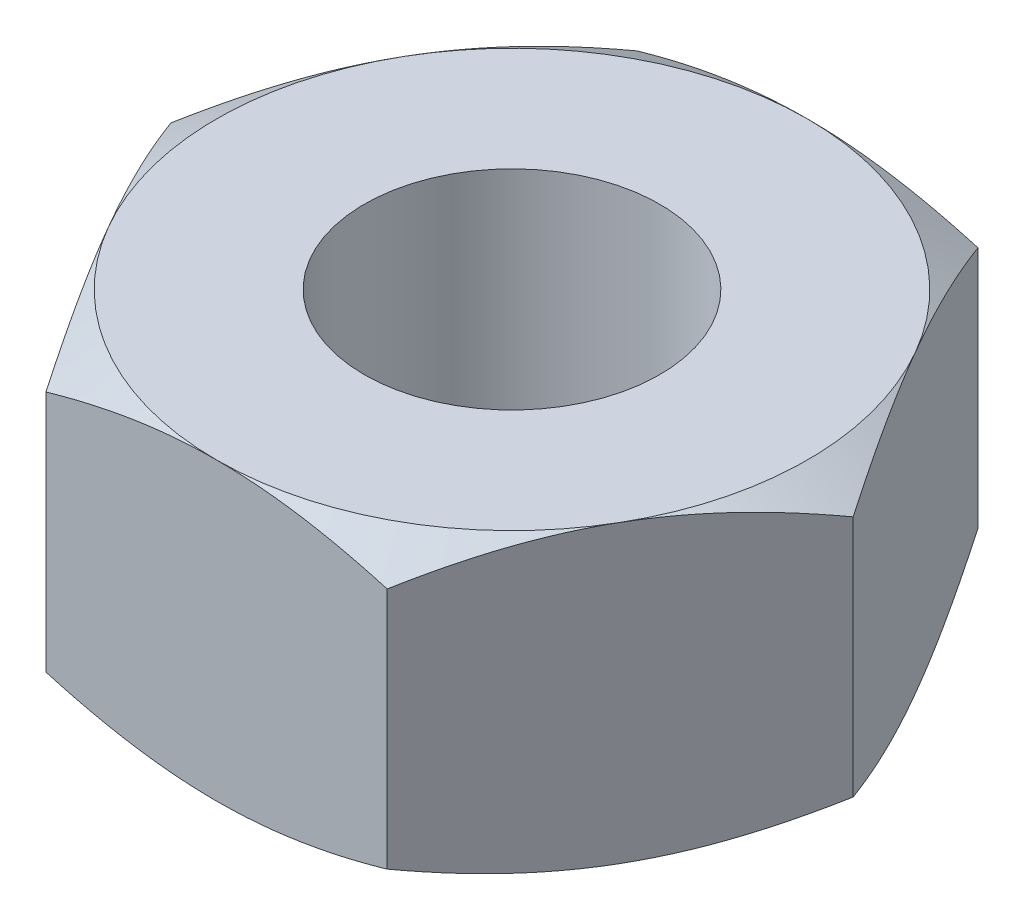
SolidWorks part; units mm, degrees
ref_plane "Plan de face" through (0, 0, 0) normal (0, 0, 1) x (1, 0, 0)
ref_plane "Plan de dessus" through (0, 0, 0) normal (0, 1, 0) x (1, 0, 0)
ref_plane "Plan de droite" through (0, 0, 0) normal (1, 0, 0) x (0, 0, -1)
sketch "Esquisse1" plane through (0, 0, 0) normal (0, 1, 0) x (1, 0, 0)
  line L1 (5.7735, 0) -> (2.8868, 5)
  line L2 (2.8868, 5) -> (-2.8868, 5)
  line L3 (-2.8868, 5) -> (-5.7735, 0)
  line L4 (-5.7735, 0) -> (-2.8868, -5)
  line L5 (-2.8868, -5) -> (2.8868, -5)
  line L6 (2.8868, -5) -> (5.7735, 0)
  circle A0 centre (0, 0) radius 5 construction
  dimension "D1" = 10
extrude "Extrusion1" add sketch "Esquisse1" along normal mid plane 5
sketch "Esquisse2" plane through (0, 0, 0) normal (1, 0, 0) x (0, 0, -1)
  line L0 (2, 4.2321) -> (8, 4.2321)
  line L1 (8, 4.2321) -> (8, 0.7679)
  line L2 (8, 0.7679) -> (2, 4.2321)
  line L3 (0, 9.378) -> (0, -1.3286) construction
  dimension "D1" = 30
  dimension "D2" = 3
revolve "Enlèvement de matière-Révolution4" cut sketch "Esquisse2" angle 360 about L3
mirror "Symétrie1" about plane through (0, 0, 0) normal (0, 1, 0) of "Enlèvement de matière-Révolution4"
sketch "Esquisse3" plane through (0, 2.5, 0) normal (0, 1, 0) x (-1, 0, 0)
  circle A0 centre (0, 0) radius 2.5
  dimension "D1" = 5
extrude "Enlèv. mat.-Extru.1" cut sketch "Esquisse3" against normal through all
